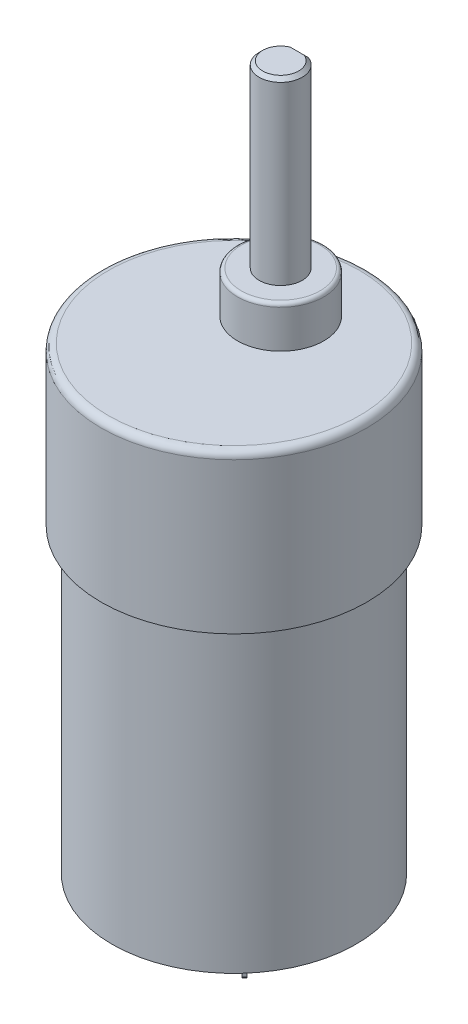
SolidWorks part; units mm, degrees
ref_plane "Front Plane" through (0, 0, 0) normal (0, 0, 1) x (1, 0, 0)
ref_plane "Top Plane" through (0, 0, 0) normal (0, 1, 0) x (1, 0, 0)
ref_plane "Right Plane" through (0, 0, 0) normal (1, 0, 0) x (0, 0, -1)
sketch "Sketch1" plane through (0, 0, 0) normal (0, 1, 0) x (1, 0, 0)
  circle A0 centre (0, 0) radius 18.5
  dimension "D1" = 37
extrude "Extrude1" add sketch "Sketch1" along normal blind 22
sketch "Sketch2" plane through (0, 22, 0) normal (0, 1, 0) x (1, 0, 0)
  circle A0 centre (0, 6.5) radius 6
  dimension "D1" = 12
  dimension "D2" = 6.5
extrude "Extrude2" add sketch "Sketch2" along normal blind 5.8
sketch "Sketch3" plane through (0, 27.8, 0) normal (0, 1, 0) x (1, 0, 0)
  line L0 (-1.0823, 9.298) -> (1.0823, 9.298)
  arc A0 (-1.0823, 9.298) -> (1.0823, 9.298) centre (0, 6.5) ccw
  dimension "D1" = 6
extrude "Extrude3" add sketch "Sketch3" along normal blind 25 separate body
sketch "Sketch4" plane through (0, 0, 0) normal (0, -1, 0) x (1, 0, 0)
  circle A0 centre (0, 0) radius 17
  dimension "D1" = 34
extrude "Extrude4" add sketch "Sketch4" along normal blind 42
sketch "Sketch5" plane through (0, -42, 0) normal (0, -1, 0) x (1, 0, 0)
  circle A0 centre (0, 0) radius 16.5
  dimension "D1" = 33
extrude "Cut-Extrude1" cut sketch "Sketch5" against normal blind 1
sketch "Sketch6" plane through (0, -41, 0) normal (0, -1, 0) x (1, 0, 0)
  circle A0 centre (0, 0) radius 5
  dimension "D1" = 10
extrude "Extrude5" add sketch "Sketch6" along normal blind 1
sketch "Sketch7" plane through (0, -42, 0) normal (0, -1, 0) x (1, 0, 0)
  circle A0 centre (0, 0) radius 3
  dimension "D1" = 6
extrude "Extrude6" add sketch "Sketch7" along normal blind 2.5
sketch "Sketch8" plane through (0, -41, 0) normal (0, -1, 0) x (1, 0, 0)
  line L0 (7.7018, 6.6091) -> (9.4695, 8.3769)
  line L1 (9.4695, 8.3769) -> (9.8231, 8.0233)
  line L2 (9.8231, 8.0233) -> (8.0553, 6.2556)
  line L3 (8.0553, 6.2556) -> (7.7018, 6.6091)
  line L4 (8.0553, -7.9559) -> (9.8231, -9.7237)
  line L5 (9.8231, -9.7237) -> (9.4695, -10.0773)
  line L6 (9.4695, -10.0773) -> (7.7018, -8.3095)
  line L7 (7.7018, -8.3095) -> (8.0553, -7.9559)
  dimension "D1" = 2.5
  dimension "D2" = 0.5
  dimension "D3" = 2.5
  dimension "D4" = 0.5
extrude "Extrude7" add sketch "Sketch8" along normal blind 5
sketch "Sketch9" plane through (0.5463, 0, -0.5463) normal (-0.7071, 0, 0.7071) x (0.7071, 0, 0.7071)
  circle A0 centre (11.3693, -45) radius 0.5
  dimension "D1" = 1
  dimension "D2" = 1
extrude "Cut-Extrude3" cut sketch "Sketch9" against normal through all
sketch "Sketch10" plane through (-0.3039, 0, -0.3039) normal (-0.7071, 0, -0.7071) x (-0.7071, 0, 0.7071)
  circle A0 centre (-12.5717, -45) radius 0.5
  dimension "D1" = 1
  dimension "D2" = 1
extrude "Cut-Extrude4" cut sketch "Sketch10" against normal through all
chamfer "Chamfer1" distance 1 angle 45 1 edges at (0, -44.5, -3)
chamfer "Chamfer2" distance 0.5 angle 45 2 edges at (9.6463, -46, -9.9005) (7.8785, -46, -8.1327)
chamfer "Chamfer3" distance 0.5 angle 45 2 edges at (7.8785, -46, 6.4324) (9.6463, -46, 8.2001)
fillet "Fillet2" radius 1 1 edges at (0, 22, 18.5)
fillet "Fillet3" radius 0.5 1 edges at (0, 27.8, -0.5)
chamfer "Chamfer4" distance 0.5 angle 45 2 edges at (0, 52.8, -9.298) (0, 52.8, -3.5)
